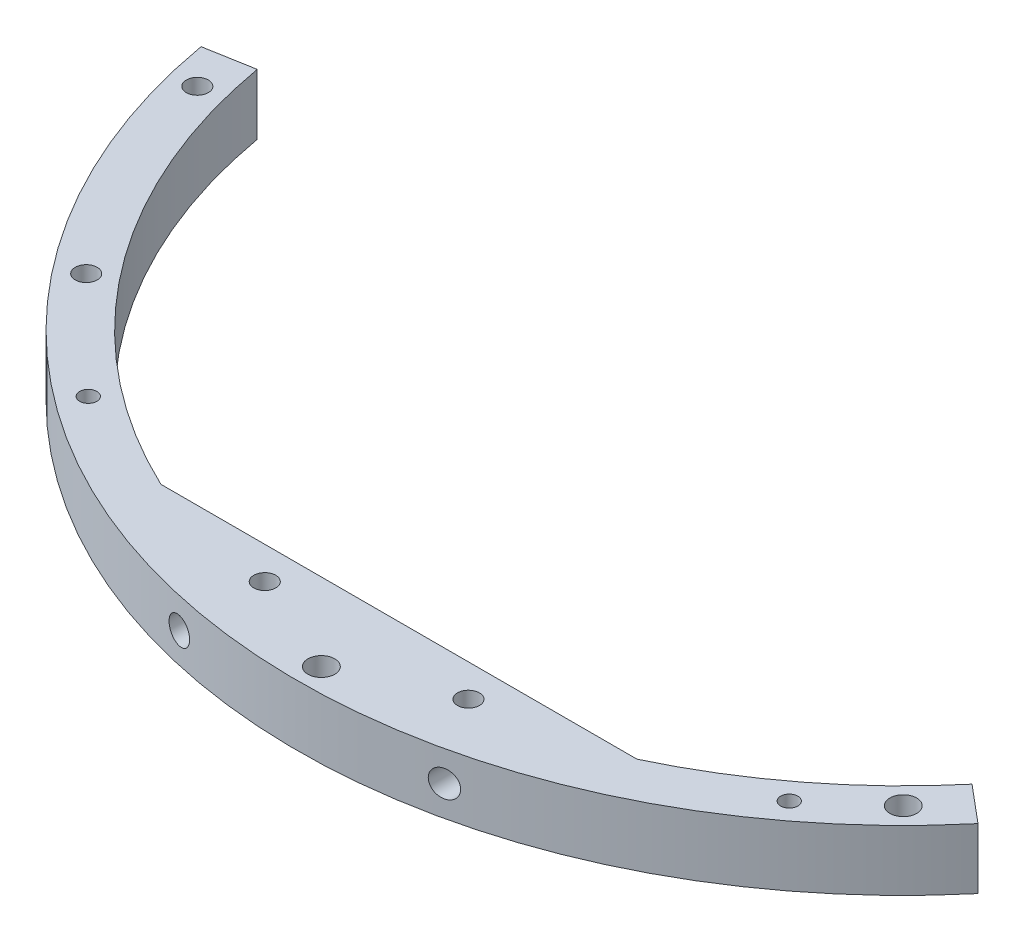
SolidWorks part; units mm, degrees
ref_plane "Front Plane" through (0, 0, 0) normal (0, 0, 1) x (1, 0, 0)
ref_plane "Top Plane" through (0, 0, 0) normal (0, 1, 0) x (1, 0, 0)
ref_plane "Right Plane" through (0, 0, 0) normal (1, 0, 0) x (0, 0, -1)
sketch "Sketch1" plane through (0, 0, 0) normal (0, 1, 0) x (1, 0, 0)
  line L0 (-67.1285, -56.3275) -> (-72.9657, -61.2255) construction
  line L1 (0, 0) -> (0, -103.3133) construction
  line L2 (67.1285, -56.3275) -> (72.9657, -61.2255)
  line L3 (37.4002, -79.248) -> (-37.4002, -79.248)
  line L4 (0, 0) -> (-86.2987, -15.2168) construction
  line L5 (-86.2987, -15.2168) -> (-93.8029, -16.54)
  arc A0 (-72.9657, -61.2255) -> (72.9657, -61.2255) centre (0, 0) ccw
  arc A1 (-67.1285, -56.3275) -> (-37.4002, -79.248) centre (0, 0) ccw
  circle A2 centre (-16.002, -84.328) radius 1.7272
  circle A3 centre (-64.6578, -64.6578) radius 2.1082 construction
  circle A4 centre (-55.073, -72.9898) radius 1.3525
  circle A5 centre (55.073, -72.9898) radius 1.3525
  circle A6 centre (64.6578, -64.6578) radius 2.1082
  circle A7 centre (16.002, -84.328) radius 1.7272
  arc A8 (67.1285, -56.3275) -> (37.4002, -79.248) centre (0, 0) cw
  circle A9 centre (0, -91.44) radius 2.1082
  arc A10 (-67.1285, -56.3275) -> (-86.2987, -15.2168) centre (0, 0) cw
  arc A11 (-72.9657, -61.2255) -> (-93.8029, -16.54) centre (0, 0) cw
  arc A12 (-90.0508, -15.8784) -> (-35.3297, -84.3391) centre (0, 0) ccw construction
  circle A13 centre (-88.6971, -22.2284) radius 1.7272
  circle A14 centre (-71.9391, -56.445) radius 1.7272
  point P5 (0, -79.248)
  dimension "D1" = 50
  dimension "D4" = 3.4544
  dimension "D2" = 12.7
  dimension "D3" = 4.2164
  dimension "D5" = 2.7051
  dimension "D6" = 4.2164
  dimension "D7" = 87.63
  dimension "D8" = 95.25
  dimension "D10" = 16.002
  dimension "D11" = 3.3528
  dimension "D12" = 12.192
  dimension "D13" = 64.6578
  dimension "D14" = 14.5902
  dimension "D15" = 55.073
  dimension "D20" = 3.4544
  dimension "D9" = 37.4002
  dimension "D16" = 7.62
  dimension "D17" = 80
  dimension "D18" = 38.1
  dimension "D19" = 6.35
extrude "Extrude1" add sketch "Sketch1" along normal blind 9.525
sketch "Sketch3" plane through (0, 0, 79.248) normal (0, 0, -1) x (-1, 0, 0)
  line L0 (0, 0) -> (0, 9.5847) construction
  line L1 (-37.4002, 0) -> (37.4002, 0) construction
  circle A0 centre (20.828, 4.7625) radius 2.0828
  circle A1 centre (-20.828, 4.7625) radius 2.0828
extrude "Cut-Extrude1" cut sketch "Sketch3" against normal through all
